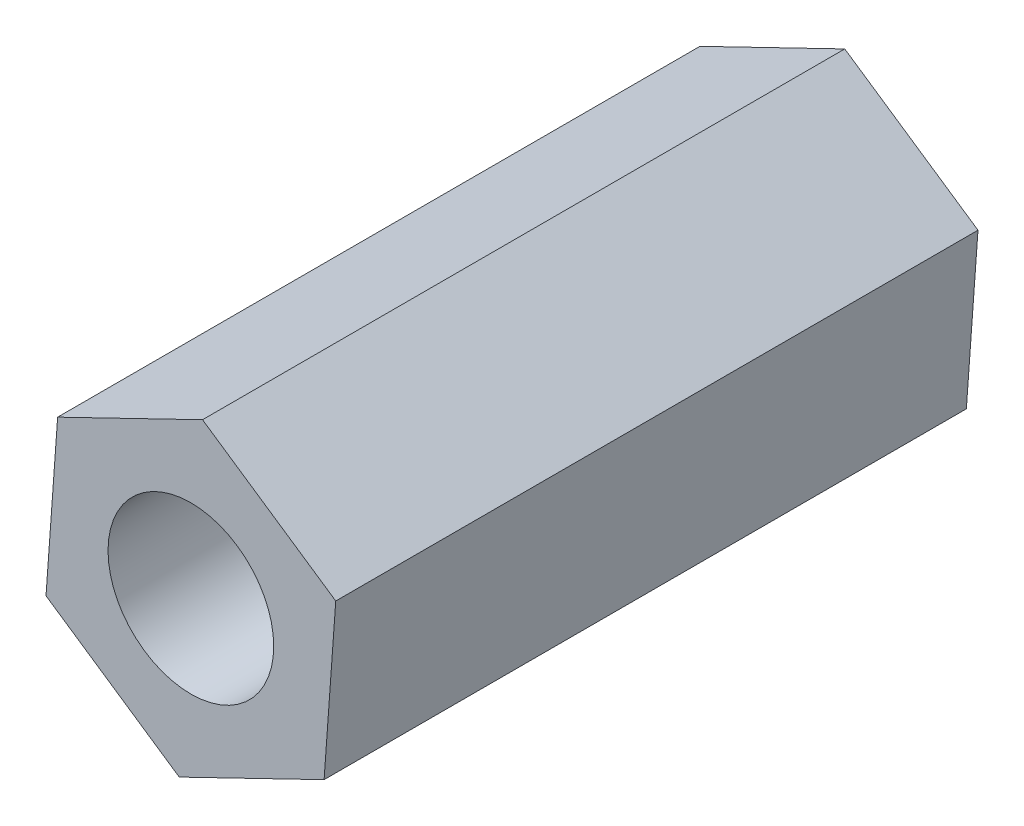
SolidWorks part; units mm, degrees
ref_plane "Front Plane" through (0, 0, 0) normal (0, 0, 1) x (1, 0, 0)
ref_plane "Top Plane" through (0, 0, 0) normal (0, 1, 0) x (1, 0, 0)
ref_plane "Right Plane" through (0, 0, 0) normal (1, 0, 0) x (0, 0, -1)
sketch "Sketch1" plane through (0, 0, 0) normal (0, 0, 1) x (1, 0, 0)
  line L1 (-37.2957, -2.5) -> (-35.04, -1.4071)
  line L2 (-35.04, -1.4071) -> (-34.8586, 1.0929)
  line L3 (-34.8586, 1.0929) -> (-36.933, 2.5)
  line L4 (-36.933, 2.5) -> (-39.1887, 1.4071)
  line L5 (-39.1887, 1.4071) -> (-39.3701, -1.0929)
  line L6 (-39.3701, -1.0929) -> (-37.2957, -2.5)
  circle A0 centre (-37.1144, 0) radius 1.29
  circle A1 centre (-37.1144, 0) radius 2.1708 construction
  point P2 (0, 0)
  point P10 (0, 0)
  dimension "D1" = 5
  dimension "D2" = 2.58
extrude "Boss-Extrude1" add sketch "Sketch1" along normal blind 10
